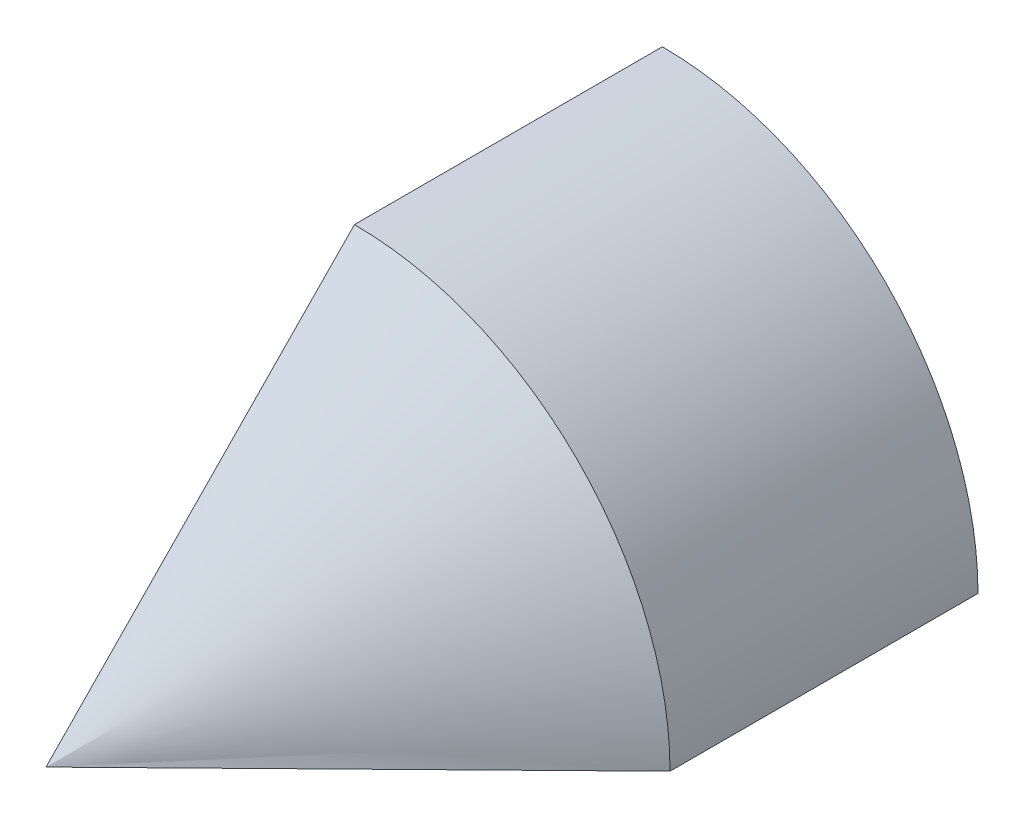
SolidWorks part; units mm, degrees
ref_plane "前视基准面" through (0, 0, 0) normal (0, 0, 1) x (1, 0, 0)
ref_plane "上视基准面" through (0, 0, 0) normal (0, 1, 0) x (1, 0, 0)
ref_plane "右视基准面" through (0, 0, 0) normal (1, 0, 0) x (0, 0, -1)
sketch "草图1" plane through (0, 0, 0) normal (1, 0, 0) x (0, 0, -1)
  line L0 (-51.0811, 0) -> (61.0403, 0) construction
  line L1 (-39.1943, 0) -> (0.8318, 40.9612)
  line L2 (0.8318, 40.9612) -> (40.8006, 40.9612)
  line L3 (40.8006, 40.9612) -> (40.8006, 0)
  line L4 (-39.1943, 0) -> (40.8006, 0)
revolve "旋转1" add sketch "草图1" angle 90 about L0
